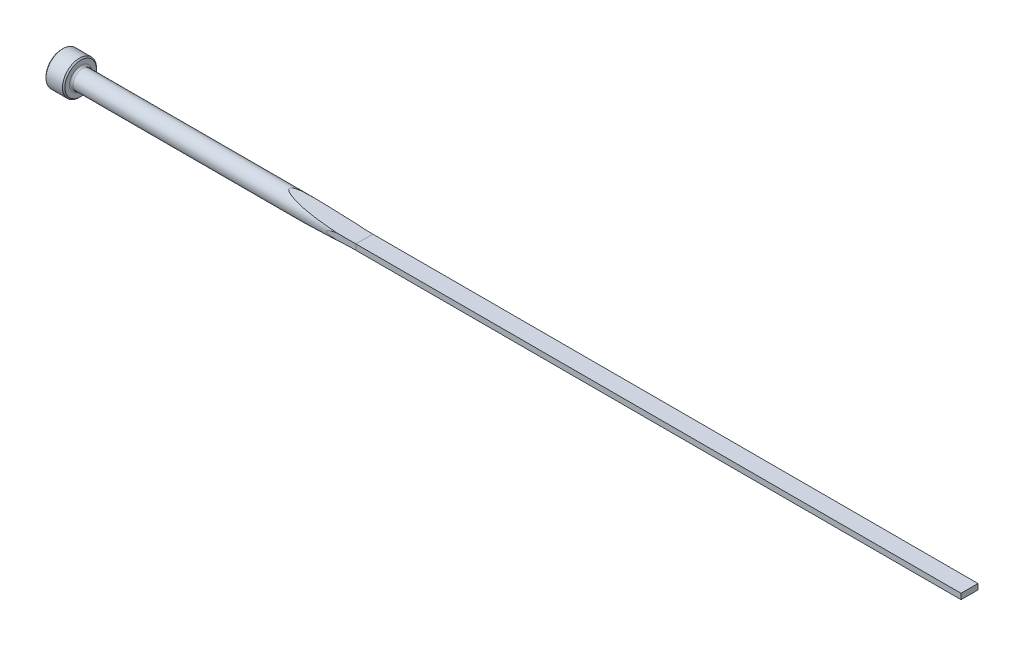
SolidWorks part; units mm, degrees
ref_plane "Front Plane" through (0, 0, 0) normal (0, 0, 1) x (1, 0, 0)
ref_plane "Top Plane" through (0, 0, 0) normal (0, 1, 0) x (1, 0, 0)
ref_plane "Right Plane" through (0, 0, 0) normal (1, 0, 0) x (0, 0, -1)
sketch "Sketch1" plane through (0, 0, 0) normal (0, 0, 1) x (1, 0, 0)
  line L0 (0, 0) -> (167.7268, 0) construction
  line L1 (0, 0) -> (0, 3.5687)
  line L2 (0, 3.5687) -> (3.9624, 3.5687)
  line L3 (3.9624, 3.5687) -> (3.9624, 1.9812)
  line L4 (3.9624, 1.9812) -> (190.5, 1.9812)
  line L5 (190.5, 1.9812) -> (190.5, 0)
  line L6 (190.5, 0) -> (0, 0)
  dimension "D1" = 190.5
  dimension "D2" = 7.1374
  dimension "D3" = 3.9624
  dimension "D4" = 3.9624
revolve "Revolve1" add sketch "Sketch1" angle 360 about L0
sketch "Sketch2" plane through (0, 0, 0) normal (0, 0, 1) x (1, 0, 0)
  line L0 (190.5, 1.9812) -> (190.5, 0.5842)
  line L1 (190.5, -1.9812) -> (190.5, 1.9812) construction
  line L2 (190.5, 0.5842) -> (63.5, 0.5842)
  line L3 (190.5, 1.9812) -> (3.9624, 1.9812) construction
  line L4 (47.8018, 1.9812) -> (190.5, 1.9812)
  line L5 (166.0833, 0) -> (153.1705, 0) construction
  arc A0 (63.5, 0.5842) -> (47.8018, 1.9812) centre (63.5, 89.4842) cw
  dimension "D1" = 88.9
  dimension "D3" = 127
  dimension "D2" = 1.1684
  dimension "D4" = 15.6982
extrude "Cut-Extrude1" cut sketch "Sketch2" against normal through all both and the other way through all
mirror "Mirror1" about plane through (0, 0, 0) normal (0, 1, 0) of "Cut-Extrude1"
sketch "Sketch3" plane through (0, 0, 0) normal (0, 1, 0) x (1, 0, 0)
  line L0 (190.5, 1.9812) -> (190.5, 1.778)
  line L1 (190.5, 1.8931) -> (190.5, -1.8931) construction
  line L2 (190.5, 1.778) -> (63.5, 1.778)
  line L3 (190.5, 1.9812) -> (3.9624, 1.9812) construction
  line L4 (57.4927, 1.9812) -> (190.5, 1.9812)
  line L5 (163.4716, 0) -> (166.2513, 0) construction
  line L6 (63.5, 1.8931) -> (63.5, -1.8931) construction
  arc A0 (63.5, 1.778) -> (57.4927, 1.9812) centre (63.5, 90.678) cw
  dimension "D2" = 88.9
  dimension "D1" = 3.556
extrude "Cut-Extrude2" cut sketch "Sketch3" against normal through all both and the other way through all
mirror "Mirror2" about plane through (0, 0, 0) normal (0, 0, 1) of "Cut-Extrude2"
fillet "Fillet1" radius 0.381 1 edges at (3.9624, 0, 1.9812)
chamfer "Chamfer1" distance 0.254 angle 45 2 edges at (0, 0, 3.5687) (3.9624, 0, 3.5687)
